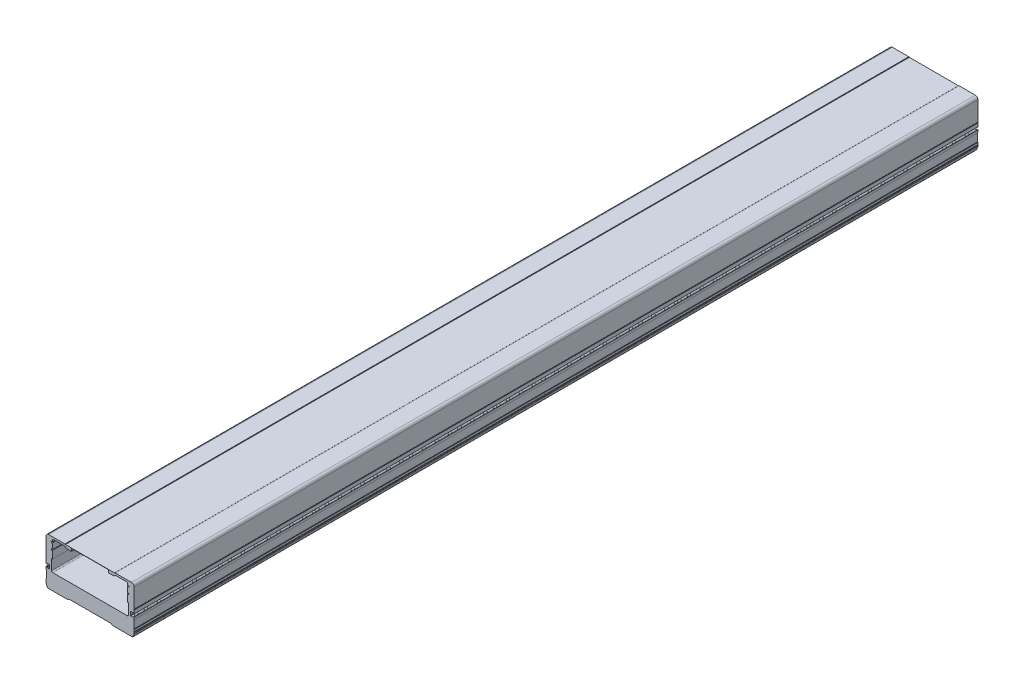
SolidWorks part; units mm, degrees
ref_plane "前视基准面" through (0, 0, 0) normal (0, 0, 1) x (1, 0, 0)
ref_plane "上视基准面" through (0, 0, 0) normal (0, 1, 0) x (1, 0, 0)
ref_plane "右视基准面" through (0, 0, 0) normal (1, 0, 0) x (0, 0, -1)
sketch "草图1" plane through (0, 0, 0) normal (0, 0, 1) x (1, 0, 0)
  line B0 (-57, 22.7) -> (57, 22.7)
  line B1 (-59, 40.3) -> (-59, 24.7)
  line B2 (-57.5, 40.6) -> (-59.3, 40.6)
  line B3 (-57.5, 52.1417) -> (-57.5, 40.6)
  line B4 (-57.5, 62.1417) -> (-57.5, 53.0583)
  line B5 (-57.5, 66.1) -> (-57.5, 63.0583)
  line B6 (-67.5, 66.1) -> (-67.5, 36.6047)
  line B7 (-67.5, 35.3953) -> (-67.5, 30.1)
  line B8 (-67.2, 29.8) -> (-65.8, 29.8)
  line B9 (-65.5, 30.1) -> (-65.5, 30.7)
  line B10 (-65.2, 31) -> (-62.3, 31)
  line B11 (-62, 30.7) -> (-62, 25.3)
  line B12 (-62.3, 25) -> (-65.2, 25)
  line B13 (-65.5, 25.3) -> (-65.5, 25.9)
  line B14 (-65.8, 26.2) -> (-67.2, 26.2)
  line B15 (-67.5, 25.9) -> (-67.5, 22.5)
  line B16 (-67.5, 22.5) -> (-67, 22)
  line B17 (-67, 22) -> (-67, 10)
  line B18 (-67, 10) -> (-67.5, 9.5)
  line B19 (-67.5, 9.5) -> (-67.5, 6.6047)
  line B20 (-67.5, 5.3953) -> (-67.5, 4.382)
  line B21 (-67.3592, 3.6449) -> (-65.5064, -1.0289)
  line B22 (-65.16, -1.6) -> (-34.1, -1.6)
  line B23 (-34.1, -1.6) -> (-32.5, 0)
  line B24 (-32.5, 0) -> (32.5, 0)
  line B25 (32.5, 0) -> (34.1, -1.6)
  line B26 (34.1, -1.6) -> (65.16, -1.6)
  line B27 (65.5064, -1.0289) -> (67.3592, 3.6449)
  line B28 (67.5, 4.382) -> (67.5, 5.3953)
  line B29 (67.5, 6.6047) -> (67.5, 9.5)
  line B30 (67.5, 9.5) -> (67, 10)
  line B31 (67, 10) -> (67, 22)
  line B32 (67, 22) -> (67.5, 22.5)
  line B33 (67.5, 22.5) -> (67.5, 25.9)
  line B34 (67.2, 26.2) -> (65.8, 26.2)
  line B35 (65.5, 25.9) -> (65.5, 25.3)
  line B36 (65.2, 25) -> (62.3, 25)
  line B37 (62, 25.3) -> (62, 30.7)
  line B38 (62.3, 31) -> (65.2, 31)
  line B39 (65.5, 30.7) -> (65.5, 30.1)
  line B40 (65.8, 29.8) -> (67.2, 29.8)
  line B41 (67.5, 30.1) -> (67.5, 35.3953)
  line B42 (67.5, 36.6047) -> (67.5, 66.1)
  line B43 (63.5, 70.1) -> (38.5, 70.1)
  line B44 (38.5, 70.1) -> (38, 69.6)
  line B45 (38, 69.6) -> (37.5, 69.6)
  line B46 (37.5, 69.6) -> (37.5, 69.7)
  line B47 (37.5, 69.7) -> (-37.5, 69.7)
  line B48 (-37.5, 69.7) -> (-37.5, 69.6)
  line B49 (-37.5, 69.6) -> (-38, 69.6)
  line B50 (-38, 69.6) -> (-38.5, 70.1)
  line B51 (-38.5, 70.1) -> (-63.5, 70.1)
  line B52 (-38.5, 67.1) -> (-56.5, 67.1)
  line B53 (-36.5, 65.1) -> (-38.5, 67.1)
  line B54 (-28.8, 65.1) -> (-36.5, 65.1)
  line B55 (-28.5, 69.3) -> (-28.5, 65.4)
  line B56 (28.5, 69.3) -> (-28.5, 69.3)
  line B57 (28.5, 65.4) -> (28.5, 69.3)
  line B58 (36.5, 65.1) -> (28.8, 65.1)
  line B59 (38.5, 67.1) -> (36.5, 65.1)
  line B60 (56.5, 67.1) -> (38.5, 67.1)
  line B61 (57.5, 63.0583) -> (57.5, 66.1)
  line B62 (57.5, 53.0583) -> (57.5, 62.1417)
  line B63 (57.5, 40.6) -> (57.5, 52.1417)
  line B64 (59, 40.6) -> (57.5, 40.6)
  line B65 (59, 24.7) -> (59, 40.6)
  arc B66 (-59, 24.7) -> (-57, 22.7) centre (-57, 24.7) ccw
  arc B67 (-59, 40.3) -> (-59.3, 40.6) centre (-59.3, 40.3) ccw
  arc B68 (-57.5, 53.0583) -> (-57.5, 52.1417) centre (-58.5, 52.6) ccw
  arc B69 (-57.5, 63.0583) -> (-57.5, 62.1417) centre (-58.5, 62.6) ccw
  arc B70 (-56.5, 67.1) -> (-57.5, 66.1) centre (-56.5, 66.1) ccw
  arc B71 (-28.8, 65.1) -> (-28.5, 65.4) centre (-28.8, 65.4) ccw
  arc B72 (28.5, 65.4) -> (28.8, 65.1) centre (28.8, 65.4) ccw
  arc B73 (57.5, 66.1) -> (56.5, 67.1) centre (56.5, 66.1) ccw
  arc B74 (57.5, 62.1417) -> (57.5, 63.0583) centre (58.5, 62.6) ccw
  arc B75 (57.5, 52.1417) -> (57.5, 53.0583) centre (58.5, 52.6) ccw
  arc B76 (57, 22.7) -> (59, 24.7) centre (57, 24.7) ccw
  arc B77 (-67.5, 36.6047) -> (-67.3333, 36.3359) centre (-67.2, 36.6047) ccw
  arc B78 (-67.3333, 35.6641) -> (-67.3333, 36.3359) centre (-67.5, 36) ccw
  arc B79 (-67.3333, 35.6641) -> (-67.5, 35.3953) centre (-67.2, 35.3953) ccw
  arc B80 (-67.5, 30.1) -> (-67.2, 29.8) centre (-67.2, 30.1) ccw
  arc B81 (-65.8, 29.8) -> (-65.5, 30.1) centre (-65.8, 30.1) ccw
  arc B82 (-65.2, 31) -> (-65.5, 30.7) centre (-65.2, 30.7) ccw
  arc B83 (-62, 30.7) -> (-62.3, 31) centre (-62.3, 30.7) ccw
  arc B84 (-62.3, 25) -> (-62, 25.3) centre (-62.3, 25.3) ccw
  arc B85 (-65.5, 25.3) -> (-65.2, 25) centre (-65.2, 25.3) ccw
  arc B86 (-65.5, 25.9) -> (-65.8, 26.2) centre (-65.8, 25.9) ccw
  arc B87 (-67.2, 26.2) -> (-67.5, 25.9) centre (-67.2, 25.9) ccw
  arc B88 (-67.5, 6.6047) -> (-67.3333, 6.3359) centre (-67.2, 6.6047) ccw
  arc B89 (-67.3333, 5.6641) -> (-67.3333, 6.3359) centre (-67.5, 6) ccw
  arc B90 (-67.3333, 5.6641) -> (-67.5, 5.3953) centre (-67.2, 5.3953) ccw
  arc B91 (-67.5, 4.382) -> (-67.3592, 3.6449) centre (-65.5, 4.382) ccw
  arc B92 (-65.5064, -1.0289) -> (-65.16, -1.6) centre (-63.6472, -0.2918) ccw
  arc B93 (65.16, -1.6) -> (65.5064, -1.0289) centre (63.6472, -0.2918) ccw
  arc B94 (67.3592, 3.6449) -> (67.5, 4.382) centre (65.5, 4.382) ccw
  arc B95 (67.5, 5.3953) -> (67.3333, 5.6641) centre (67.2, 5.3953) ccw
  arc B96 (67.3333, 6.3359) -> (67.3333, 5.6641) centre (67.5, 6) ccw
  arc B97 (67.3333, 6.3359) -> (67.5, 6.6047) centre (67.2, 6.6047) ccw
  arc B98 (67.5, 25.9) -> (67.2, 26.2) centre (67.2, 25.9) ccw
  arc B99 (65.8, 26.2) -> (65.5, 25.9) centre (65.8, 25.9) ccw
  arc B100 (65.2, 25) -> (65.5, 25.3) centre (65.2, 25.3) ccw
  arc B101 (62, 25.3) -> (62.3, 25) centre (62.3, 25.3) ccw
  arc B102 (62.3, 31) -> (62, 30.7) centre (62.3, 30.7) ccw
  arc B103 (65.5, 30.7) -> (65.2, 31) centre (65.2, 30.7) ccw
  arc B104 (65.5, 30.1) -> (65.8, 29.8) centre (65.8, 30.1) ccw
  arc B105 (67.2, 29.8) -> (67.5, 30.1) centre (67.2, 30.1) ccw
  arc B106 (67.5, 35.3953) -> (67.3333, 35.6641) centre (67.2, 35.3953) ccw
  arc B107 (67.3333, 36.3359) -> (67.3333, 35.6641) centre (67.5, 36) ccw
  arc B108 (67.3333, 36.3359) -> (67.5, 36.6047) centre (67.2, 36.6047) ccw
  arc B109 (67.5, 66.1) -> (63.5, 70.1) centre (63.5, 66.1) ccw
  arc B110 (-63.5, 70.1) -> (-67.5, 66.1) centre (-63.5, 66.1) ccw
sketch_block_instance "块1-1"
sketch_block "块1"
extrude "凸台-拉伸1" add sketch "草图1" along normal blind 1193
hole_wizard "M6 螺纹孔1" positions "草图2" profile "草图3" tap size "M6" standard "GB"
sketch "草图2" plane through (0, -1.6, 0) normal (0, -1, 0) x (-1, 0, 0)
  line L0 (0, -1193) -> (0, -464.3791) construction
  line L3 (32.5, -1193) -> (-32.5, -1193) construction
  line L4 (65.16, -1193) -> (34.1, -1193) construction
  point P0 (53, -1141.5)
  point P9 (-53, -1141.5)
  point P13 (53, -941.5)
  point P15 (53, -741.5)
  point P17 (53, -541.5)
  point P19 (53, -341.5)
  point P21 (53, -141.5)
  point P23 (53, 58.5)
  point P27 (-53, -141.5)
  point P28 (-53, -341.5)
  point P29 (-53, -541.5)
  point P30 (-53, -741.5)
  point P31 (-53, -941.5)
  point P37 (-53, 58.5)
  dimension "D1" = 106
  dimension "D2" = 51.5
  dimension "D3" = 200
  dimension "D4" = 200
  dimension "D5" = 200
  dimension "D6" = 200
  dimension "D7" = 200
  dimension "D8" = 200
sketch "草图3" plane through (-53, -1.6, 1141.5) normal (1, 0, 0) x (0, 0, -1)
  line L0 (0, 0) -> (0, 13.5022)
  line L1 (0, 13.5022) -> (2.5, 12)
  line L2 (2.5, 12) -> (2.5, 0)
  line L5 (2.5, 0) -> (0, 0)
  line L10 (0, 13.5022) -> (-2.5, 12) construction
  line L11 (0, -6.35) -> (0, 107.95) construction
  dimension "螺纹孔钻头直径" = 5
  dimension "螺纹孔钻头深度" = 12
  dimension "导头角度" = 118
